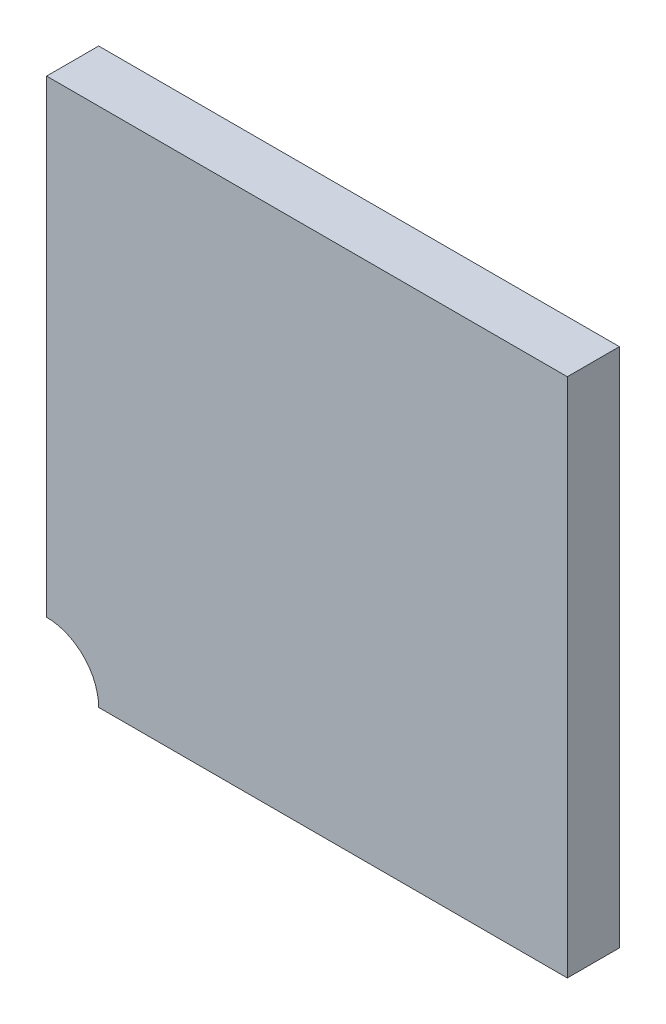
SolidWorks part; units mm, degrees
ref_plane "Plane1" through (0, 0, 0) normal (0, 0, 1) x (1, 0, 0)
ref_plane "Plane2" through (0, 0, 0) normal (0, 1, 0) x (1, 0, 0)
ref_plane "Plane3" through (0, 0, 0) normal (1, 0, 0) x (0, 0, -1)
sketch "Sketch1" plane through (0, 0, 0) normal (0, 0, 1) x (1, 0, 0)
  line L0 (-25.4, -152.4) -> (-25.4, 76.2)
  line L1 (-25.4, 76.2) -> (228.6, 76.2)
  line L2 (228.6, 76.2) -> (228.6, -177.8)
  line L3 (228.6, -177.8) -> (0, -177.8)
  arc A0 (-25.4, -152.4) -> (0, -177.8) centre (-25.4, -177.8) cw
  dimension "D4" = 25.4
  dimension "D1" = 254
  dimension "D2" = 254
  dimension "D3" = 228.6
extrude "Base-Extrude" add sketch "Sketch1" along normal blind 25.4
mirror "Mirror1" [suppressed]
mirror "Mirror2" [suppressed]
surface "Surface-MidSurface1" parameters "D0"=50000
